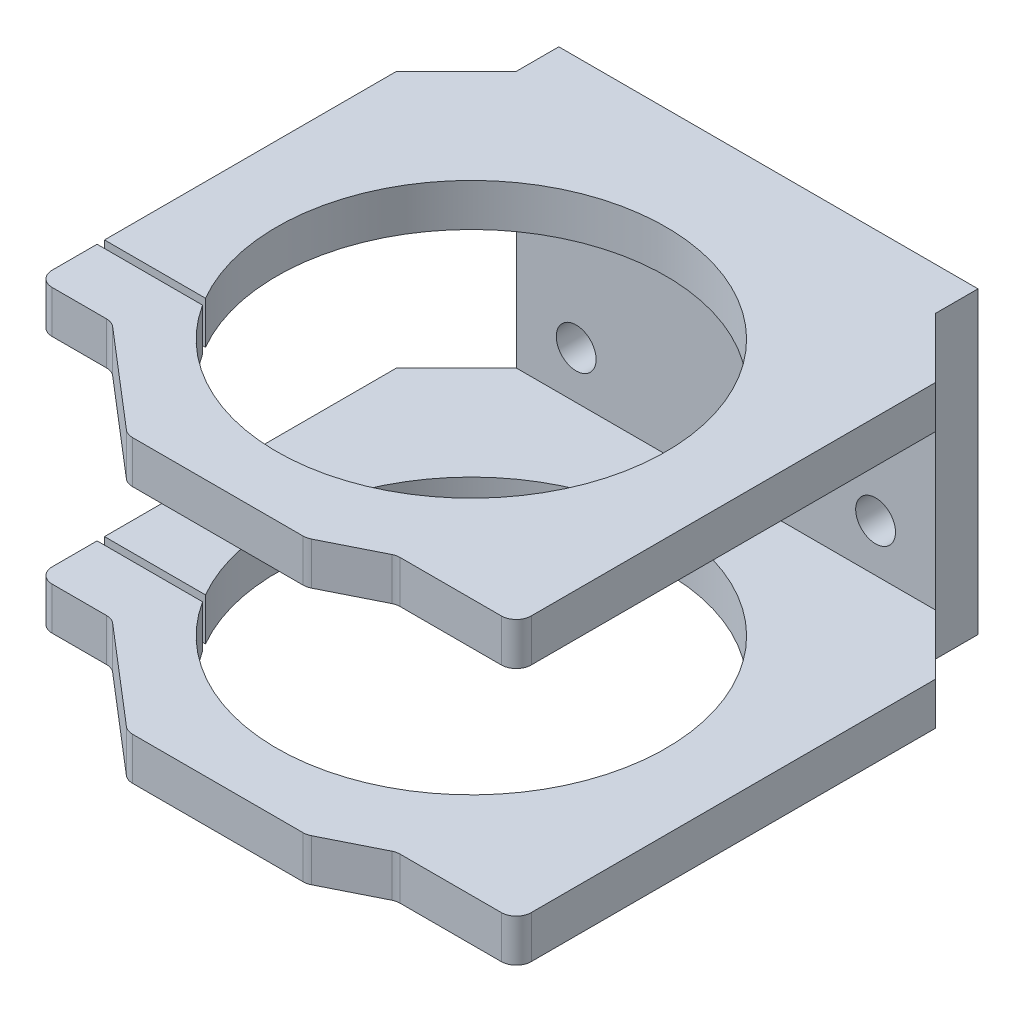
SolidWorks part; units mm, degrees
ref_plane "Front" through (0, 0, 0) normal (0, 0, 1) x (1, 0, 0)
ref_plane "Top" through (0, 0, 0) normal (0, 1, 0) x (1, 0, 0)
ref_plane "Right" through (0, 0, 0) normal (1, 0, 0) x (0, 0, -1)
sketch "Sketch1" plane through (0, 0, 0) normal (0, 0, 1) x (1, 0, 0)
  line L0 (0, 0) -> (20.7396, 0) construction
  line L1 (-44.45, -31.75) -> (44.45, -31.75)
  line L2 (-44.45, -31.75) -> (-44.45, 31.75)
  line L3 (-44.45, 31.75) -> (44.45, 31.75)
  line L4 (44.45, -31.75) -> (44.45, 31.75)
  line L5 (0, 0) -> (0, 18.1668) construction
  dimension "D1" = 63.5
  dimension "D2" = 88.9
extrude "Extrude1" add sketch "Sketch1" along normal blind 9.017
sketch "Sketch2" plane through (0, 0, 9.017) normal (0, 0, 1) x (1, 0, 0)
  line L0 (0, 31.75) -> (0, -31.75) construction
  line L1 (44.45, 31.75) -> (-44.45, 31.75) construction
  line L2 (-44.45, -31.75) -> (44.45, -31.75) construction
  line L3 (-44.45, 0) -> (44.45, 0) construction
  line L4 (-44.45, 31.75) -> (-44.45, -31.75) construction
  line L5 (44.45, -31.75) -> (44.45, 31.75) construction
  circle A4 centre (-31.75, 12.7) radius 4.2228
  circle A5 centre (31.75, 12.7) radius 4.2227
  circle A6 centre (-31.75, -12.7) radius 4.2228
  circle A7 centre (31.75, -12.7) radius 4.2227
  dimension "D4" = 8.4455
  dimension "D6" = 25.4
  dimension "D5" = 63.5
extrude "Cut-Extrude1" cut sketch "Sketch2" against normal through all
sketch "Sketch3" plane through (0, 31.75, 0) normal (0, 1, 0) x (-1, 0, 0)
  line L0 (0, 0) -> (0, 116.967) construction
  line L1 (-44.45, 9.017) -> (-57.15, 21.717)
  line L2 (57.15, 21.717) -> (57.15, 83.6422)
  line L3 (-44.45, 9.017) -> (44.45, 9.017) construction
  line L4 (-57.15, 21.717) -> (-57.15, 110.617)
  line L6 (-44.45, 9.017) -> (-44.45, 0) construction
  line L7 (44.45, 9.017) -> (57.15, 21.717)
  line L8 (-44.45, 9.017) -> (44.45, 9.017)
  line L9 (-57.15, 110.617) -> (-31.75, 110.617)
  line L10 (-31.75, 110.617) -> (-19.05, 116.967)
  line L11 (-19.05, 116.967) -> (19.05, 116.967)
  line L12 (57.15, 97.917) -> (41.275, 97.917)
  line L13 (41.275, 97.917) -> (19.05, 116.967)
  line L14 (0, 21.717) -> (-35.5659, 21.717) construction
  line L15 (57.15, 85.217) -> (34.7804, 85.217)
  line L16 (57.15, 83.6422) -> (35.7379, 83.6422)
  line L17 (57.15, 85.217) -> (57.15, 97.917)
  arc A0 (34.7804, 85.217) -> (35.7379, 83.6422) centre (0, 62.992) ccw
  dimension "D9" = 82.55
  dimension "D10" = 12.7
  dimension "D1" = 135
  dimension "D2" = 114.3
  dimension "D3" = 101.6
  dimension "D4" = 38.1
  dimension "D5" = 25.4
  dimension "D6" = 107.95
  dimension "D7" = 88.9
  dimension "D8" = 15.875
  dimension "D11" = 12.7
  dimension "D12" = 12.7
  dimension "D13" = 1.5748
extrude "Extrude2" add sketch "Sketch3" against normal blind 9.017
fillet "Fillet1" radius 3.175 6 edges at (-41.275, 27.2415, 97.917) (-19.05, 27.2415, 116.967) (57.15, 27.2415, 110.617) (19.05, 27.2415, 116.967) (31.75, 27.2415, 110.617) (-57.15, 27.2415, 97.917)
mirror "Mirror1" about plane through (0, 0, 0) normal (0, 1, 0) of "Fillet1", "Extrude2"
